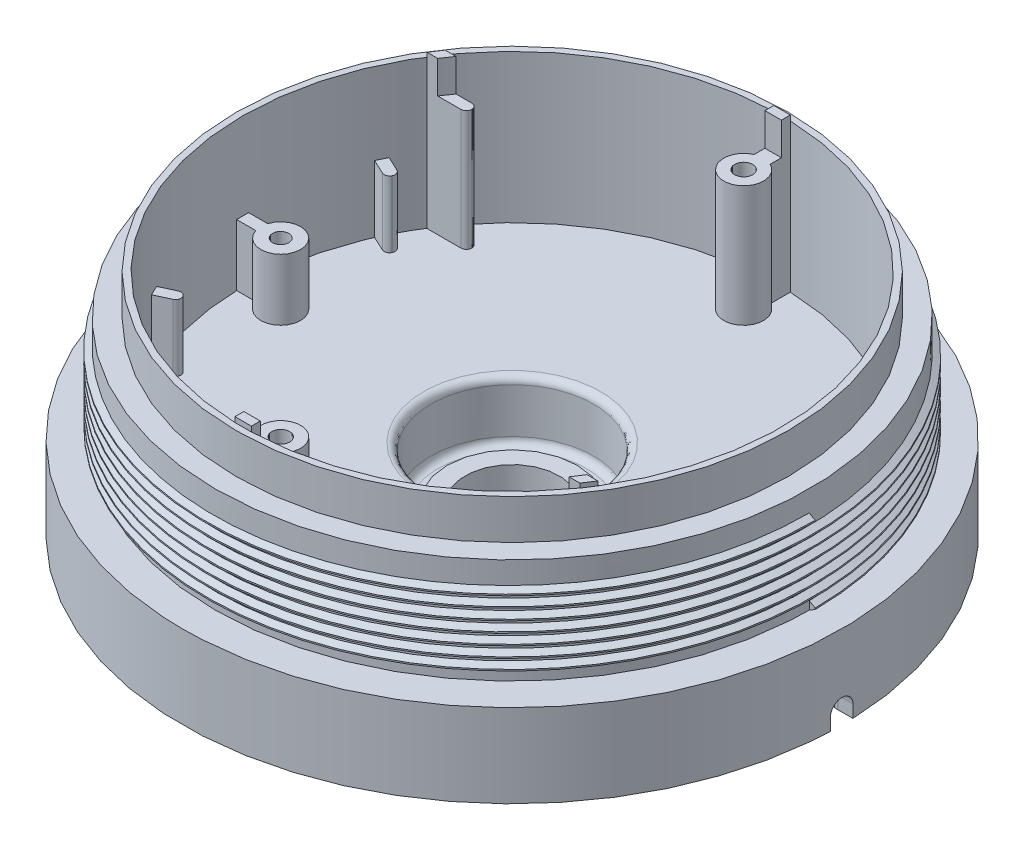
SolidWorks part; units mm, degrees
ref_plane "Alzado" through (0, 0, 0) normal (0, 0, 1) x (1, 0, 0)
ref_plane "Planta" through (0, 0, 0) normal (0, 1, 0) x (1, 0, 0)
ref_plane "Vista lateral" through (0, 0, 0) normal (1, 0, 0) x (0, 0, -1)
sketch "Croquis1" plane through (0, 0, 0) normal (0, 1, 0) x (1, 0, 0)
  line L0 (5.7, 3.1241) -> (5.7, -3.1241)
  circle A0 centre (0, 0) radius 45.555
  arc A1 (5.7, 3.1241) -> (5.7, -3.1241) centre (0, 0) ccw
  dimension "D1" = 91.11
  dimension "D2" = 13
  dimension "D3" = 6.2482
extrude "Saliente-Extruir1" add sketch "Croquis1" along normal blind 31.5
ref_plane "Plano1" through (0, 31.5, 0) normal (0, 1, 0) x (1, 0, 0)
sketch "Croquis2" plane through (0, 31.5, 0) normal (0, 1, 0) x (1, 0, 0)
  circle A0 centre (0, 0) radius 37.25
extrude "Cortar-Extruir3" cut sketch "Croquis2" against normal blind 20.5
sketch "Croquis3" plane through (0, 31.5, 0) normal (0, 1, 0) x (1, 0, 0)
  circle A1 centre (0, 0) radius 38.125
  dimension "D1" = 76.25
extrude "Cortar-Extruir4" cut sketch "Croquis3" against normal blind 5.5 flip side to cut
ref_plane "Plano2" through (0, 11, 0) normal (0, 1, 0) x (1, 0, 0)
sketch "Croquis4" plane through (0, 11, 0) normal (0, 1, 0) x (1, 0, 0)
  line L0 (5.7, -3.1241) -> (5.7, 3.1241) construction
  line L2 (34.6142, 0.825) -> (37.2409, 0.825)
  line L4 (34.6142, -0.825) -> (37.2409, -0.825)
  arc A0 (34.6142, 0.825) -> (34.6142, -0.825) centre (31.9909, 0) ccw
  circle A1 centre (0, 0) radius 37.25 construction
  arc A2 (37.2409, -0.825) -> (37.2409, 0.825) centre (0, 0) ccw
  point P5 (5.7, 0)
  point P6 (29.2409, 0)
  dimension "D1" = 5.5
  dimension "D2" = 8
extrude "Saliente-Extruir2" add sketch "Croquis4" along normal blind 8.5
sketch "Croquis6" plane through (0, 19.5, 0) normal (0, 1, 0) x (1, 0, 0)
  circle A0 centre (31.9909, 0) radius 1.125
extrude "Cortar-Extruir5" cut sketch "Croquis6" against normal blind 6
mirror "Simetría1" about plane through (0, 0, 0) normal (1, 0, 0) of "Cortar-Extruir5", "Saliente-Extruir2"
sketch "Croquis7" plane through (0, 11, 0) normal (0, 1, 0) x (1, 0, 0)
  line L2 (1.1902, 37.231) -> (1.1902, 34.4594)
  line L4 (-1.081, 37.2343) -> (-1.081, 34.509)
  arc A0 (-1.081, 34.509) -> (1.1902, 34.4594) centre (0, 31.9803) ccw
  arc A1 (37.2409, 0.825) -> (-37.2409, 0.825) centre (0, 0) ccw construction
  arc A2 (1.1902, 37.231) -> (-1.081, 37.2343) centre (0, 0) ccw
  point P2 (-0.0599, 29.231)
  dimension "D1" = 5.5
  dimension "D2" = 8
extrude "Saliente-Extruir3" add sketch "Croquis7" along normal blind 21.2
sketch "Croquis11" plane through (0, 32.2, 0) normal (0, 1, 0) x (1, 0, 0)
  line L0 (-0.0753, 35.9999) -> (-0.0753, 37.2499) construction
  line L1 (3.1138, 35.9999) -> (-3.2645, 35.9999)
  line L2 (3.1138, 35.9999) -> (3.1138, 29.1189)
  line L3 (3.1138, 29.1189) -> (-3.2645, 29.1189)
  line L4 (-3.2645, 35.9999) -> (-3.2645, 29.1189)
  arc A0 (1.1902, 37.231) -> (-1.081, 37.2343) centre (0, 0) ccw construction
  dimension "D1" = 1.25
extrude "Cortar-Extruir6" cut sketch "Croquis11" against normal blind 4.5 contours L2 L1 L4 L3
sketch "Croquis12" plane through (0, 27.7, 0) normal (0, 1, 0) x (1, 0, 0)
  circle A0 centre (0, 31.9803) radius 1.25
extrude "Cortar-Extruir7" cut sketch "Croquis12" against normal blind 8
mirror "Simetría3" about plane through (0, 0, 0) normal (0, 0, 1) of "Saliente-Extruir3", "Cortar-Extruir6", "Cortar-Extruir7"
sketch "Croquis13" plane through (0, 11, 0) normal (0, 1, 0) x (1, 0, 0)
  line L0 (0, -39.427) -> (0, -27.2303) construction
  line L1 (-4.5826, -29.2303) -> (4.5826, -29.2303) construction
  arc A0 (1.1902, -34.4594) -> (-1.081, -34.509) centre (0, -31.9803) ccw construction
  circle A1 centre (0, -33.4803) radius 6.25
  dimension "D2" = 12.5
  dimension "D1" = 2
extrude "Saliente-Extruir4" add sketch "Croquis13" along normal blind 3
sketch "Croquis14" plane through (0, 11, 0) normal (0, 1, 0) x (1, 0, 0)
  line L0 (0.0546, 37.25) -> (0.0546, 21.25) construction
  line L1 (0.0546, 21.25) -> (-30.5238, 21.25) construction
  line L3 (-26.0832, 21.25) -> (-30.5238, 21.25)
  line L4 (-26.0832, 21.25) -> (-26.0832, 19.75)
  line L5 (-26.0832, 19.75) -> (-31.5004, 19.75)
  arc A0 (1.1902, 37.231) -> (-1.081, 37.2343) centre (0, 0) ccw construction
  arc A3 (-30.5238, 21.25) -> (-31.5004, 19.75) centre (0.1955, 0.1814) ccw
  dimension "D1" = 16
  dimension "D2" = 1.5
  dimension "D3" = 5.4172
  dimension "D4" = 0.9766
extrude "Saliente-Extruir5" add sketch "Croquis14" along normal blind 21.1
sketch "Croquis15" plane through (0, 32.1, 0) normal (0, 1, 0) x (1, 0, 0)
  line L0 (-28.9993, 21.26) -> (-26.0832, 21.2727)
  line L1 (-26.0832, 21.2727) -> (-26.0832, 19.75)
  line L2 (-26.0832, 19.75) -> (-30.039, 19.75)
  arc A2 (-28.9993, 21.26) -> (-30.039, 19.75) centre (0.0811, 0.124) ccw
  dimension "D1" = 1.51
extrude "Cortar-Extruir8" cut sketch "Croquis15" against normal blind 4.5
fillet "Redondeo1" radius 0.75 2 edges at (-26.0832, 19.3, -21.25) (-26.0832, 19.3, -19.75)
sketch "Croquis16" plane through (0, 11, 0) normal (0, 1, 0) x (1, 0, 0)
  line L0 (0.0546, -37.25) -> (0.0546, -20.5) construction
  line L1 (0.0546, -20.5) -> (45.5505, -20.5) construction
  line L2 (0.0546, -21.25) -> (45.5505, -21.25) construction
  line L3 (30.6032, -21.25) -> (26.1632, -21.25)
  line L5 (31.5832, -19.75) -> (26.1632, -19.75)
  line L6 (26.1632, -21.25) -> (26.1632, -19.75)
  arc A0 (-1.081, -37.2343) -> (1.1902, -37.231) centre (0, 0) ccw construction
  arc A1 (30.6032, -21.25) -> (31.5832, -19.75) centre (1.3272, -1.0528) ccw
  arc A4 (5.2452, -36.8789) -> (37.2409, -0.825) centre (0, 0) ccw construction
  dimension "D5" = 0.75
  dimension "D1" = 16.75
  dimension "D2" = 1.5
  dimension "D3" = 5.42
  dimension "D4" = 4.44
extrude "Saliente-Extruir6" add sketch "Croquis16" along normal blind 21.1
sketch "Croquis17" plane through (0, 32.1, 0) normal (0, 1, 0) x (1, 0, 0)
  line L10 (26.1632, -19.75) -> (26.1632, -21.25)
  line L11 (26.1632, -21.25) -> (29.1032, -21.25)
  line L12 (30.0832, -19.75) -> (26.1632, -19.75)
  arc A3 (29.1032, -21.25) -> (30.0832, -19.75) centre (-0.1728, -1.0528) ccw
  dimension "D1" = 1.5
  dimension "D2" = 3.92
  dimension "D3" = 2.94
extrude "Cortar-Extruir9" cut sketch "Croquis17" against normal blind 4.5
fillet "Redondeo3" radius 0.75 2 edges at (26.1632, 19.3, 21.25) (26.1632, 19.3, 19.75)
sketch "Croquis19" plane through (0, 11, 0) normal (0, 1, 0) x (1, 0, 0)
  line L0 (0, 0) -> (-33.76, 15.7425) construction
  line L1 (-33.4334, 16.4177) -> (-30.7145, 15.1499)
  line L2 (-30.7145, 15.1499) -> (-31.3676, 13.7995)
  line L3 (-31.3676, 13.7995) -> (-34.0865, 15.0673)
  line L4 (-34.0865, 15.0673) -> (-33.4334, 16.4177)
  line L5 (0, 0) -> (-56.1851, 0) construction
  line L6 (-33.4334, 16.4177) -> (-31.3676, 13.7995) construction
  point P4 (-33.76, 15.7425)
  dimension "D1" = 25
  dimension "D2" = 1.5
  dimension "D3" = 3
extrude "Saliente-Extruir7" add sketch "Croquis19" along normal blind 9.2
fillet "Redondeo4" radius 0.75 2 edges at (-31.3676, 15.6, -13.7995) (-30.7145, 15.6, -15.1499)
mirror "Simetría4" about plane through (0, 0, 0) normal (0, 0, 1) of "Redondeo4", "Saliente-Extruir7"
mirror "Simetría5" about plane through (0, 0, 0) normal (1, 0, 0) of "Simetría4", "Saliente-Extruir7", "Redondeo4"
sketch "Croquis20" plane through (0, 11, 0) normal (0, 1, 0) x (1, 0, 0)
  line L0 (28.7537, -21.25) -> (-7.4593, -21.25) construction
  line L1 (26.9132, -21.25) -> (30.5941, -21.25) construction
  line L2 (16.1632, -13.9663) -> (16.1632, -43.2605) construction
  circle A0 centre (13.7882, -23.625) radius 2.375
  dimension "D1" = 10
  dimension "D2" = 23.625
extrude "Saliente-Extruir8" add sketch "Croquis20" along normal blind 4.2
sketch "Croquis21" plane through (0, 15.2, 0) normal (0, 1, 0) x (1, 0, 0)
  circle A0 centre (13.7882, -23.625) radius 0.5
extrude "Cortar-Extruir10" cut sketch "Croquis21" against normal through all
sketch "Croquis22" plane through (0, 11, 0) normal (0, 1, 0) x (1, 0, 0)
  circle A0 centre (0, 0) radius 11.25
extrude "Cortar-Extruir11" cut sketch "Croquis22" against normal blind 7.2
sketch "Croquis23" plane through (0, 3.8, 0) normal (0, 1, 0) x (1, 0, 0)
  circle A0 centre (0, 0) radius 9
  circle A2 centre (0, 0) radius 11.25
  circle A3 centre (0, 0) radius 11.25
  dimension "D1" = 0
extrude "Cortar-Extruir12" cut sketch "Croquis23" against normal blind 1
fillet "Redondeo5" radius 1 2 edges at (0, 2.8, 11.25) (0, 11, 11.25)
sketch "Croquis24" plane through (0, 26, 0) normal (0, 1, 0) x (1, 0, 0)
  circle A1 centre (0, 0) radius 41.05
extrude "Cortar-Extruir13" cut sketch "Croquis24" against normal blind 14.5 flip side to cut
sketch "Croquis31" plane through (0, 0, 0) normal (0, -1, 0) x (1, 0, 0)
  circle A0 centre (0, 0) radius 43.5
  circle A1 centre (0, 0) radius 12.5
extrude "Cortar-Extruir15" cut sketch "Croquis31" against normal blind 8.75
fillet "Redondeo6" radius 1 2 edges at (0, 8.75, -12.5) (0, 0, -12.5)
sketch "Croquis32" plane through (0, 8.75, 0) normal (0, -1, 0) x (-1, 0, 0)
  circle A0 centre (-13.7882, -23.625) radius 2
extrude "Cortar-Extruir16" cut sketch "Croquis32" against normal blind 2
fillet "Redondeo7" radius 0.25 1 edges at (13.7882, 10.75, 21.625)
sketch "Croquis34" plane through (0, 8.75, 0) normal (0, -1, 0) x (1, 0, 0)
  circle A1 centre (0, 33.4803) radius 4.75
  dimension "D2" = 9.5
  dimension "D1" = 33.4803
extrude "Cortar-Extruir17" cut sketch "Croquis34" against normal blind 5
fillet "Redondeo8" radius 0.5 2 edges at (0, 13.75, 28.7303) (0, 8.75, 28.7303)
sketch "Croquis35" plane through (0, 0, 0) normal (0, -1, 0) x (1, 0, 0)
  line L0 (42.9273, -2.5) -> (43.1777, -2.5)
  line L31 (42.9273, 2.5) -> (43.4281, 2.5)
  line L33 (41.9375, -9.5) -> (42.45, -9.5)
  line L39 (42.7639, -4.5) -> (43.0153, -4.5)
  arc A4 (42.45, -9.5) -> (43.4281, 2.5) centre (0, 0) ccw
  arc A6 (43.0153, -4.5) -> (43.1777, -2.5) centre (0, 0) ccw
  arc A7 (41.9375, -9.5) -> (42.7639, -4.5) centre (0, 0) ccw
  arc A8 (42.9273, -2.5) -> (42.9273, 2.5) centre (0, 0) ccw
  dimension "D3" = 86
  dimension "D1" = 87
  dimension "D2" = 86.5
extrude "Saliente-Extruir9" add sketch "Croquis35" against normal blind 5 separate body
ref_plane "Plano3" through (40, 0, 0) normal (1, 0, 0) x (0, 0, -1)
sketch "Croquis36" plane through (40, 0, 0) normal (1, 0, 0) x (0, 0, -1)
  line L0 (-2.5, 5) -> (9.5, 4.7)
  line L1 (9.5, 5) -> (9.5, 0) construction
  dimension "D1" = 0.3
surface "Superficie-Extruir1" sketch "Croquis36" parameters "D1"=10
other "Cortar con superficie3"
pattern_circular "MatrizC4" count 3 over 360 about axis through (0, 0, 0) along (0, 1, 0)
sketch "Croquis37" plane through (40, 0, 0) normal (1, 0, 0) x (0, 0, -1)
  line L0 (-45.555, 0) -> (45.555, 0) construction
  line L1 (-1.55, 0) -> (1.55, 0)
  line L2 (-1.55, 0) -> (-1.55, 1.75)
  line L4 (1.55, 0) -> (1.55, 1.75)
  line L5 (-3.9049, 3.3) -> (3.9551, 3.3) construction
  arc A0 (1.55, 1.75) -> (-1.55, 1.75) centre (0, 1.75) ccw
  dimension "D1" = 3.1
  dimension "D2" = 3.3
extrude "Cortar-Extruir18" cut sketch "Croquis37" along normal through all
thread "Rosca2" pitch 1.5 start angle 0, offset 0, length 0, pitch 1.5, diameter 82.1
ref_plane "Plano5" through (41.05, 11.5, 0) normal (0, 0, 1) x (1, 0, 0)
sketch "Perfil de rosca2" plane through (41.05, 11.5, 0) normal (0, 0, 1) x (1, 0, 0)
  line L0 (0, 0) -> (0, 1.5) construction
  line L1 (0, 0) -> (0.8119, 0.4687)
  line L2 (0.8119, 0.4687) -> (0.8119, 0.6562)
  line L3 (0.8119, 0.6562) -> (0, 1.125)
  line L4 (0.8119, 0.5625) -> (0, 0.5625) construction
  line L11 (0, 0) -> (0, 1.125)
  point P2 (0, 0)
  dimension "Pitch" = 1.5
  dimension "Profile_Angle" = 60
  dimension "Profile_Land" = 0.1875
  dimension "Profile_Height" = 0.8119
